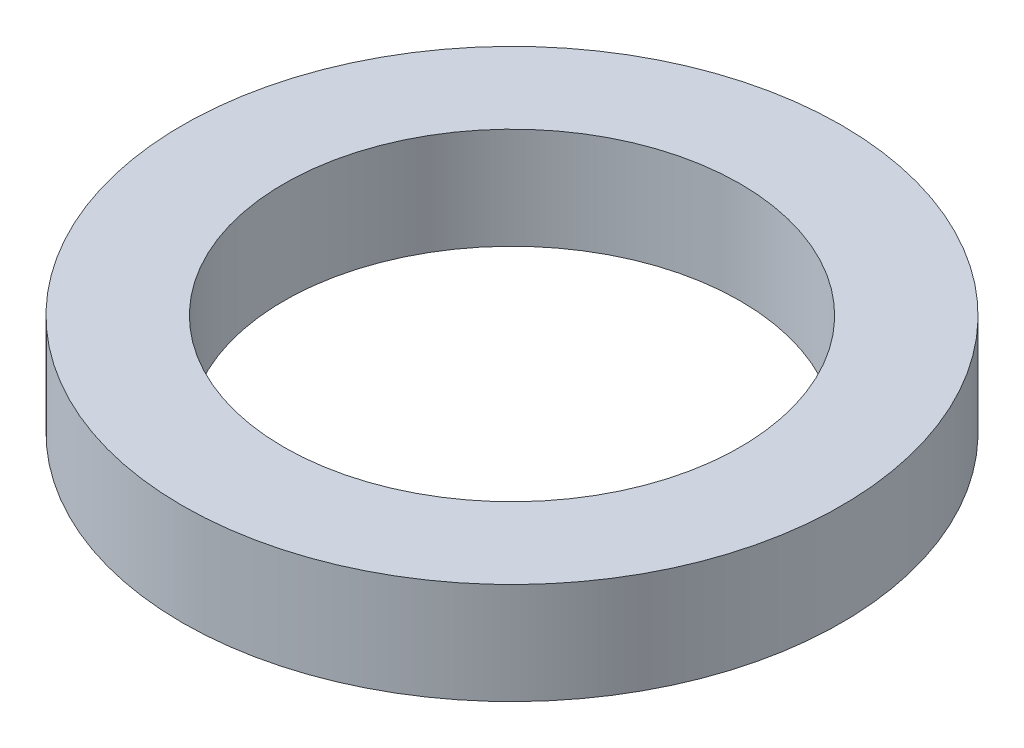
SolidWorks part; units mm, degrees
ref_plane "Face" through (0, 0, 0) normal (0, 0, 1) x (1, 0, 0)
ref_plane "Dessus" through (0, 0, 0) normal (0, 1, 0) x (1, 0, 0)
ref_plane "Droite" through (0, 0, 0) normal (1, 0, 0) x (0, 0, -1)
sketch "Esquisse2" plane through (0, 0, 0) normal (0, 1, 0) x (1, 0, 0)
  circle A0 centre (0, 0) radius 3.25
  circle A1 centre (0, 0) radius 2.25
  dimension "D1" = 6.5
  dimension "D2" = 4.5
extrude "Base-Extrusion" add sketch "Esquisse2" along normal blind 1
